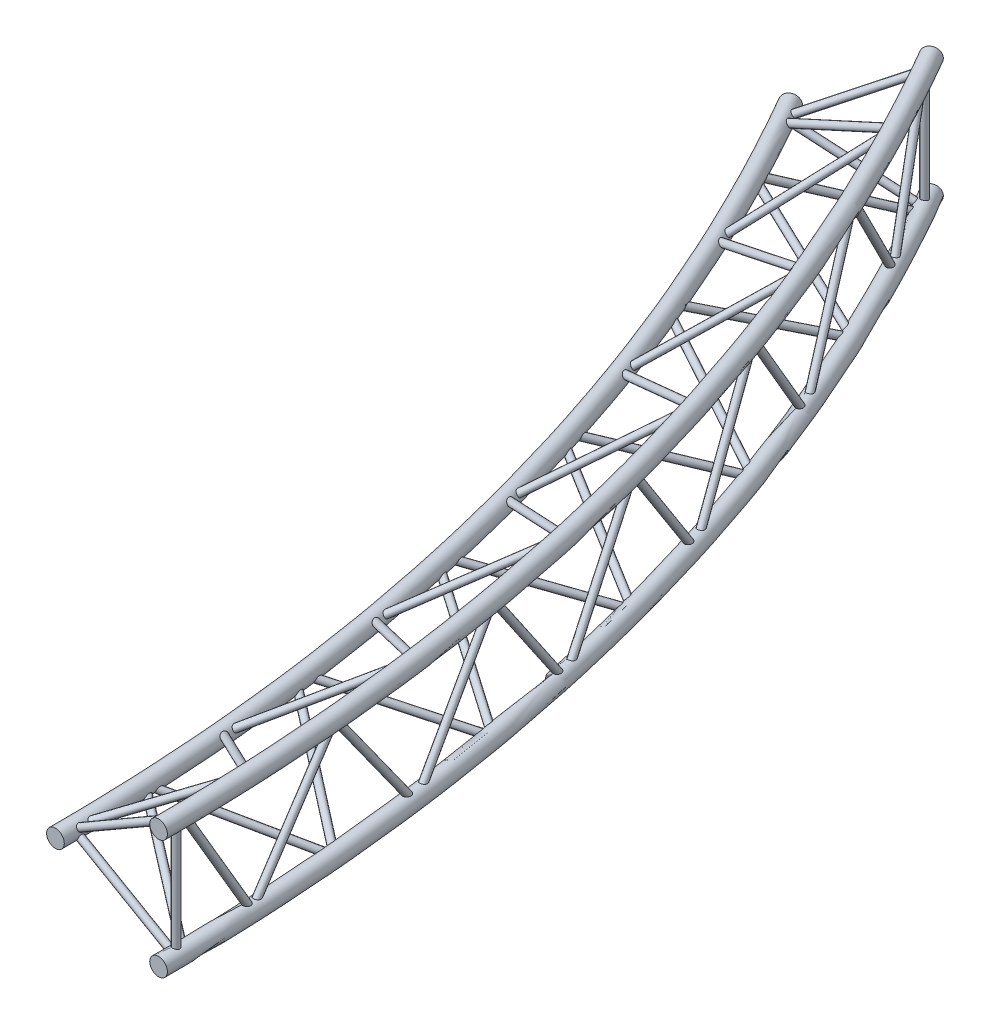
SolidWorks part; units mm, degrees
ref_plane "Face" through (0, 0, 0) normal (0, 0, 1) x (1, 0, 0)
ref_plane "Dessus" through (0, 0, 0) normal (0, 1, 0) x (1, 0, 0)
ref_plane "Droite" through (0, 0, 0) normal (1, 0, 0) x (0, 0, -1)
sketch "Esquisse1" plane through (0, 0, 0) normal (0, 0, 1) x (1, 0, 0)
  line L0 (5975, 168.5) -> (5683.1494, 0) construction
  line L1 (5683.1494, 0) -> (5975, -168.5) construction
  line L2 (5975, -168.5) -> (5975, 168.5) construction
  line L3 (5877.7165, 61.5908) -> (5877.7165, -61.5908) construction
  line L4 (72.9361, 0) -> (11682.4968, 0) construction
  line L5 (5877.7165, 0) -> (5975, 168.5)
  line L8 (6000, -168.5) -> (6000, 107.8926) construction
  line L9 (0, 252.4415) -> (0, -235.2114) construction
  circle A0 centre (5877.7165, 0) radius 194.567 construction
  circle A1 centre (5975, 168.5) radius 25
  circle A2 centre (5683.1494, 0) radius 25
  circle A3 centre (5975, -168.5) radius 25
  dimension "D1" = 60
  dimension "D2" = 50
  dimension "D3" = 337
  dimension "D4" = 6000
revolve "Révolution1" add sketch "Esquisse1" angle 30 about L9
ref_point "Point1"
ref_plane "Plan1" through (0, 0, 0) normal (0, 1, 0) x (-1, 0, 0)
sketch "cercle1" plane through (0, 0, 0) normal (0, 1, 0) x (-1, 0, 0)
  circle A0 centre (0, 0) radius 5683.1494
ref_point "Point2"
ref_plane "Plan2" through (0, -168.5, 0) normal (0, 1, 0) x (-1, 0, 0)
sketch "cercle2" plane through (0, -168.5, 0) normal (0, 1, 0) x (-1, 0, 0)
  circle A0 centre (0, 0) radius 5975
ref_point "Point3"
ref_plane "Plan3" through (0, 168.5, 0) normal (0, 1, 0) x (-1, 0, 0)
sketch "cercle3" plane through (0, 168.5, 0) normal (0, 1, 0) x (-1, 0, 0)
  circle A0 centre (0, 0) radius 5975
ref_point "Point4"
ref_plane "Plan4" through (0, 0, 0) normal (0, 1, 0) x (-1, 0, 0)
sketch "cercle4" plane through (0, 0, 0) normal (0, 1, 0) x (-1, 0, 0)
  circle A0 centre (0, 0) radius 5877.7165
ref_plane "plan_sym" through (0, 0, 0) normal (0.2588, 0, 0.9659) x (0.9659, 0, -0.2588)
sketch3d "Esquisse3D1"
  line L0 (5974.7908, 168.5, -49.9996) -> (5682.9295, 0, -49.9999)
  line L1 (5682.9295, 0, -49.9999) -> (5974.7908, -168.5, -49.9996)
  line L2 (5974.7908, -168.5, -49.9996) -> (5974.7908, 168.5, -49.9996)
  line L3 (5683.1494, 0, 0) -> (5975, -168.5, 0) construction
  circle A0 centre (0, 168.5, 0) radius 5975 construction
  circle A1 centre (0, 0, 0) radius 5683.1494 construction
  circle A2 centre (0, -168.5, 0) radius 5975 construction
  circle A3 centre (5975, 168.5, 0) radius 25 construction
  point P4 (0, 6143.5, 0)
  point P7 (0, 5683.1494, 0)
  point P11 (0, 5806.5, 0)
  point P14 (5975, 168.5, 25)
  dimension "D1" = 50
  dimension "D2" = 50
  dimension "D3" = 50
ref_plane "Plan6" through (5682.9295, 0, -49.9999) normal (-0.866, -0.5, 0) x (0.5, -0.866, -0.0001)
sketch "Esquisse8" plane through (5682.9295, 0, -49.9999) normal (-0.866, -0.5, 0) x (0.5, -0.866, -0.0001)
  circle A0 centre (0, 0) radius 10
  dimension "D1" = 20
sweep "treilli droit départ" add profiles "Esquisse8" path "Esquisse3D1"
mirror "treilli droit fin" about plane through (0, 0, 0) normal (0.2588, 0, 0.9659) of "treilli droit départ"
sketch3d "Esquisse3D2"
  line L0 (5974.59, -168.5, -69.9988) -> (5677.2014, 0, -259.946)
  line L1 (5683.1494, 0, 0) -> (5975, -168.5, 0) construction
  circle A0 centre (0, -168.5, 0) radius 5975 construction
  circle A1 centre (0, 0, 0) radius 5683.1494 construction
  point P4 (0, 5806.5, 0)
  point P7 (0, 5683.1494, 0)
  dimension "D1" = 70
  dimension "D2" = 259.963
ref_plane "Plan7" through (5677.2014, 0, -259.946) normal (-0.7605, 0.4309, -0.4857) x (-0.5331, 0.0127, 0.8459)
sketch "Esquisse9" plane through (5677.2014, 0, -259.946) normal (-0.7605, 0.4309, -0.4857) x (-0.5331, 0.0127, 0.8459)
  circle A0 centre (0, 0) radius 10
  dimension "D1" = 20
sweep "treilli depart 1" add profiles "Esquisse9" path "Esquisse3D2"
sketch3d "Esquisse3D3"
  line L0 (5682.7183, 0, -69.9987) -> (5969.3447, 168.5, -259.9015)
  circle A0 centre (0, 0, 0) radius 5683.1494 construction
  circle A1 centre (0, 168.5, 0) radius 5975 construction
  point P4 (0, 5683.1494, 0)
  point P7 (0, 6143.5, 0)
  dimension "D1" = 70
  dimension "D2" = 259.963
ref_plane "Plan8" through (5682.7183, 0, -69.9987) normal (0.7486, 0.4401, -0.496) x (-0.6556, 0.603, -0.4545)
sketch "Esquisse10" plane through (5682.7183, 0, -69.9987) normal (0.7486, 0.4401, -0.496) x (-0.6556, 0.603, -0.4545)
  circle A0 centre (0, 0) radius 10
  dimension "D1" = 20
sweep "treilli depart 2" add profiles "Esquisse10" path "Esquisse3D3"
sketch3d "Esquisse3D4"
  line L0 (5974.59, 168.5, -69.9988) -> (5968.9013, -168.5, -269.8941)
  circle A0 centre (0, 168.5, 0) radius 5975 construction
  circle A1 centre (0, -168.5, 0) radius 5975 construction
  point P4 (0, 6143.5, 0)
  point P7 (0, 5806.5, 0)
  dimension "D1" = 269.963
  dimension "D2" = 70
ref_plane "Plan9" through (5968.9013, -168.5, -269.8941) normal (-0.0145, -0.86, -0.5101) x (0.9998, -0.0183, 0.0024)
sketch "Esquisse11" plane through (5968.9013, -168.5, -269.8941) normal (-0.0145, -0.86, -0.5101) x (0.9998, -0.0183, 0.0024)
  circle A0 centre (0, 0) radius 10
  dimension "D1" = 20
sweep "treilli depart 3" add profiles "Esquisse11" path "Esquisse3D4"
mirror "treillis fin" about plane through (0, 0, 0) normal (0.2588, 0, 0.9659) of "treilli depart 1", "treilli depart 2", "treilli depart 3"
sketch3d "Esquisse3D6"
  line L0 (5969.3447, 168.5, -259.9015) -> (5661.6041, 0, -494.3955)
  line L1 (5944.3955, 153.833, -243.3715) -> (5700.1683, 10.2584, -81.5601) construction
  circle A0 centre (0, 168.5, 0) radius 5975 construction
  circle A1 centre (0, 0, 0) radius 5683.1494 construction
  point P4 (0, 6143.5, 0)
  point P7 (0, 5683.1494, 0)
  dimension "D1" = 422
ref_plane "Plan11" through (5661.6041, 0, -494.3955) normal (-0.7292, -0.3993, -0.5557) x (0.6682, -0.5905, -0.4526)
sketch "Esquisse12" plane through (5661.6041, 0, -494.3955) normal (-0.7292, -0.3993, -0.5557) x (0.6682, -0.5905, -0.4526)
  circle A0 centre (0, 0) radius 10
  dimension "D1" = 20
sweep "treilli int 1" add profiles "Esquisse12" path "Esquisse3D6"
ref_plane "Plan10" through (0, 0, 0) normal (0.087, 0, 0.9962) x (0.9962, 0, -0.087)
sketch3d "Esquisse3D7"
  line L2 (5968.9113, -168.5, -269.6712) -> (5952.3482, 168.5, -519.7845)
  circle A0 centre (0, 168.5, 0) radius 5975 construction
  circle A1 centre (0, -168.5, 0) radius 5975 construction
  point P4 (0, 6143.5, 0)
  point P5 (0, 5806.5, 0)
  dimension "D1" = 420
ref_plane "Plan12" through (5952.3482, 168.5, -519.7845) normal (-0.0394, 0.8024, -0.5955) x (-0.9744, 0.1011, 0.2008)
sketch "Esquisse13" plane through (5952.3482, 168.5, -519.7845) normal (-0.0394, 0.8024, -0.5955) x (-0.9744, 0.1011, 0.2008)
  circle A0 centre (0, 0) radius 10
  dimension "D1" = 20
sweep "treilli int 2" add profiles "Esquisse13" path "Esquisse3D7"
sketch3d "Esquisse3D9"
  line L0 (5677.2014, 0, -259.946) -> (5952.3482, -168.5, -519.7845)
  line L1 (5956.863, -158.4559, -81.3213) -> (5701.0817, -13.5305, -244.6932) construction
  circle A0 centre (0, 0, 0) radius 5683.1494 construction
  circle A1 centre (0, -168.5, 0) radius 5975 construction
  point P4 (0, 5683.1494, 0)
  point P7 (0, 5806.5, 0)
  dimension "D1" = 414.2633
ref_plane "Plan13" through (5677.2014, 0, -259.946) normal (0.6642, -0.4067, -0.6272) x (-0.6815, 0.0153, -0.7316)
sketch "Esquisse14" plane through (5677.2014, 0, -259.946) normal (0.6642, -0.4067, -0.6272) x (-0.6815, 0.0153, -0.7316)
  circle A0 centre (0, 0) radius 10
  dimension "D1" = 20
sweep "treilli int 3" add profiles "Esquisse14" path "Esquisse3D9"
sketch3d "Esquisse3D10"
  line L0 (5924.0427, 168.5, -778.68) -> (5661.6041, 0, -494.3955)
  circle A0 centre (0, 168.5, 0) radius 5975 construction
  circle A1 centre (0, 0, 0) radius 5683.1494 construction
  point P4 (0, 6143.5, 0)
  point P7 (0, 5683.1494, 0)
  dimension "D1" = 422
ref_plane "Plan14" through (5924.0427, 168.5, -778.68) normal (-0.6219, -0.3993, 0.6737) x (0.7776, -0.2135, 0.5913)
sketch "Esquisse15" plane through (5924.0427, 168.5, -778.68) normal (-0.6219, -0.3993, 0.6737) x (0.7776, -0.2135, 0.5913)
  circle A0 centre (0, 0) radius 10
  dimension "D1" = 20
sweep "treilli int4" add profiles "Esquisse15" path "Esquisse3D10"
sketch3d "Esquisse3D11"
  line L0 (5952.3482, 168.5, -519.7845) -> (5925.3093, -168.5, -768.983)
  circle A0 centre (0, -168.5, 0) radius 5975 construction
  point P5 (0, 5806.5, 0)
  dimension "D1" = 420
ref_plane "Plan15" through (5925.3093, -168.5, -768.983) normal (-0.0644, -0.8024, -0.5933) x (-0.9578, 0.2166, -0.189)
sketch "Esquisse16" plane through (5925.3093, -168.5, -768.983) normal (-0.0644, -0.8024, -0.5933) x (-0.9578, 0.2166, -0.189)
  circle A0 centre (0, 0) radius 10
  dimension "D1" = 20
sweep "treilli int 5" add profiles "Esquisse16" path "Esquisse3D11"
sketch3d "Esquisse3D12"
  line L0 (5952.3482, -168.5, -519.7845) -> (5636.3289, 0, -727.9999)
  circle A0 centre (0, 0, 0) radius 5683.1494 construction
  point P5 (0, 5683.1494, 0)
  dimension "D1" = 414.2633
ref_plane "Plan16" through (5952.3482, -168.5, -519.7845) normal (-0.7628, 0.4067, -0.5026) x (-0.5498, 0.0011, 0.8353)
sketch "Esquisse17" plane through (5952.3482, -168.5, -519.7845) normal (-0.7628, 0.4067, -0.5026) x (-0.5498, 0.0011, 0.8353)
  circle A0 centre (0, 0) radius 10
  dimension "D1" = 20
sweep "treilli int 6" add profiles "Esquisse17" path "Esquisse3D12"
sketch "Esquisse19" plane through (0, 0, 0) normal (0, 1, 0) x (1, 0, 0)
  line L0 (5661.6041, 494.3955) -> (0, 0)
  line L1 (0, 0) -> (5969.3447, 259.9015)
  line L2 (5944.3955, 243.3715) -> (5700.1683, 81.5601) construction
  line L3 (-267.1923, -23.3324) -> (267.1923, 23.3324) construction
  line L4 (5952.1104, 273.0338) -> (5690.3153, 472.518) construction
  circle A1 centre (0, 0) radius 5683.1494 construction
  circle A2 centre (0, 0) radius 5975 construction
  dimension "D1" = 2.498
pattern_circular "Répétition circulaire1" count 5 every 4.995 of "treilli int 1", "treilli int 3", "treilli int 2"
pattern_circular "Répétition circulaire2" count 5 every 4.995 of "treilli int4", "treilli int 6", "treilli int 5"
sketch3d "Esquisse3D13"
  line L0 (5209.1467, 168.5, -2926.6732) -> (5046.5814, 0, -2613.4657)
  circle A0 centre (0, 168.5, 0) radius 5975 construction
  circle A1 centre (0, 0, 0) radius 5683.1494 construction
  point P4 (0, 6143.5, 0)
  point P7 (0, 5683.1494, 0)
  dimension "D1" = 259.963
  dimension "D2" = 70
ref_plane "Plan17" through (5209.1467, 168.5, -2926.6732) normal (-0.4157, -0.4309, 0.8009) x (0.731, 0.3657, 0.5761)
sketch "Esquisse21" plane through (5209.1467, 168.5, -2926.6732) normal (-0.4157, -0.4309, 0.8009) x (0.731, 0.3657, 0.5761)
  circle A0 centre (0, 0) radius 10
  dimension "D1" = 20
sweep "treilli sym 1" [suppressed] add profiles "Esquisse21" path "Esquisse3D13"
sketch3d "Esquisse3D14"
  line L0 (5304.1989, 168.5, -2750.6543) -> (5209.1467, -168.5, -2926.6732)
  circle A0 centre (0, 168.5, 0) radius 5975 construction
  circle A1 centre (0, -168.5, 0) radius 5975 construction
  point P4 (0, 6143.5, 0)
  point P7 (0, 5806.5, 0)
  dimension "D1" = 70
  dimension "D2" = 269.963
ref_plane "Plan18" [suppressed] through (2859.8111, -168.5, -2760.8161) normal (-0.3417, -0.8631, -0.372) x (0.8125, -0.4702, 0.3446)
sketch "Esquisse22" [suppressed] plane through (2859.8111, -168.5, -2760.8161) normal (-0.3417, -0.8631, -0.372) x (0.8125, -0.4702, 0.3446)
  circle A0 centre (-5.0885, 0) radius 10
  dimension "D1" = 20
sweep "treilli sym 2" [suppressed] add profiles "Esquisse22" path "Esquisse3D14"
sketch3d "Esquisse3D15"
  line L0 (5039.6534, -168.5, -3209.7536) -> (4956.3784, 0, -2780.7374)
  circle A0 centre (0, -168.5, 0) radius 5975 construction
  circle A1 centre (0, 0, 0) radius 5683.1494 construction
  circle A3 centre (5174.5018, -168.5, -2987.5) radius 25 construction
  point P4 (0, 5806.5, 0)
  point P7 (0, 5683.1494, 0)
  point P13 (5187.0018, -168.5, -2965.8494)
  dimension "D1" = 70
  dimension "D2" = 259.963
ref_plane "Plan19" [suppressed] through (2986.5368, -168.5, -2623.2085) normal (-0.8776, 0.4439, 0.1812) x (0.2505, 0.1022, 0.9627)
sketch "Esquisse23" [suppressed] plane through (2986.5368, -168.5, -2623.2085) normal (-0.8776, 0.4439, 0.1812) x (0.2505, 0.1022, 0.9627)
  circle A0 centre (0, 0) radius 10
  dimension "D1" = 20
sweep "treilli sym 3" [suppressed] add profiles "Esquisse23" path "Esquisse3D15"
equation "\"D1@plan_sym\"=\"D1@Révolution1\"/2"
equation "\"pas_theorique\"=500"
equation "\"demi_pas_theorique\"=\"pas_theorique\"/2"
equation "\"nb_demi_pas_theorique\"=(2*\"D4@Esquisse1\"* pi -2*70)/(\"demi_pas_theorique\")"
equation "\"nb_arche\"=360/\"D1@Révolution1\""
equation "\"nb_demi_pas_th_2\"=\"nb_demi_pas_theorique\"/\"nb_arche\""
equation "\"nb_demi_pas_entier\"=int(\"nb_demi_pas_th_2\")-1"
equation "\"D2@Esquisse3D2\" = 70+(\"nb_demi_pas_th_2\"-\"nb_demi_pas_entier\")*\"pas_theorique\"/4"
equation "\"D2@Esquisse3D3\" = \"D2@Esquisse3D2\""
equation "\"D1@Esquisse3D4\"=\"D2@Esquisse3D2\"+10"
equation "\"D1@Esquisse3D10\" = \"D1@Esquisse3D6\""
equation "\"D1@Esquisse3D11\" = \"D1@Esquisse3D7\""
equation "\"D1@Esquisse3D12\" = \"D1@Esquisse3D9\""
equation "\"D2@Répétition circulaire1\"=\"D1@Esquisse19\"*2"
equation "\"D1@Esquisse3D13\" = \"D2@Esquisse3D2\""
equation "\"D2@Esquisse3D14\" = \"D1@Esquisse3D4\""
equation "\"D2@Esquisse3D15\" = \"D2@Esquisse3D3\""
equation "\"D2@Répétition circulaire2\" = \"D1@Esquisse19\"*2"
